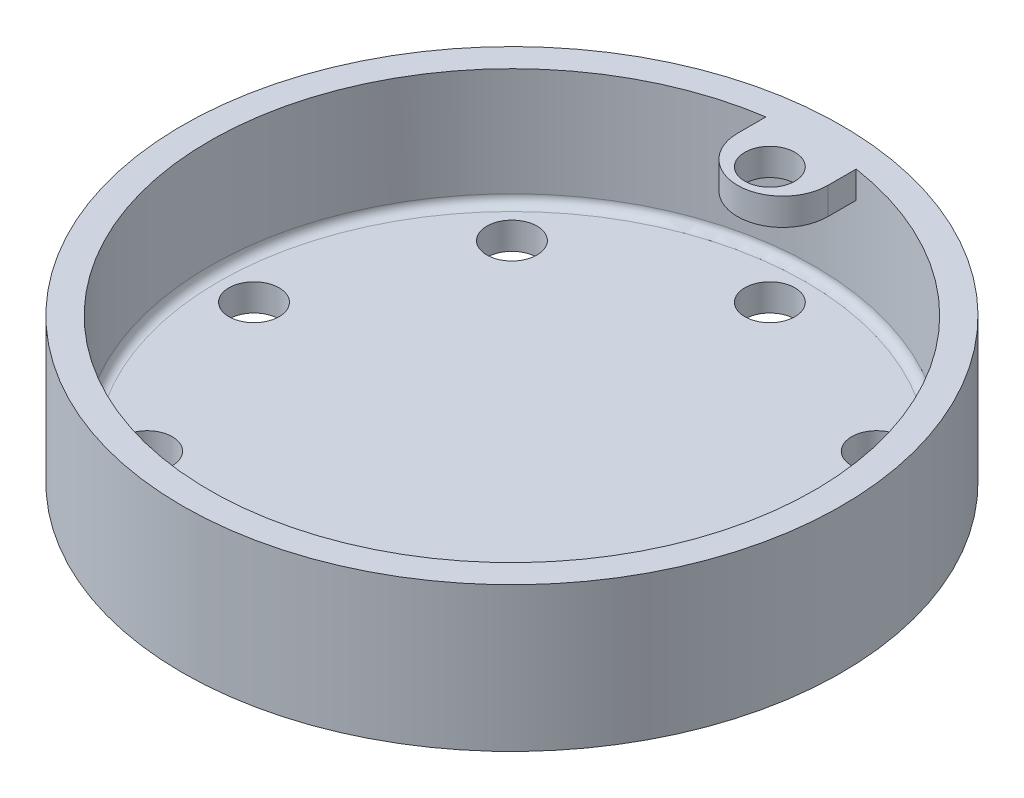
SolidWorks part; units mm, degrees
ref_plane "Front" through (0, 0, 0) normal (0, 0, 1) x (1, 0, 0)
ref_plane "Top" through (0, 0, 0) normal (0, 1, 0) x (1, 0, 0)
ref_plane "Right" through (0, 0, 0) normal (1, 0, 0) x (0, 0, -1)
sketch "Sketch1" plane through (0, 0, 0) normal (0, 1, 0) x (1, 0, 0)
  circle A0 centre (0, 0) radius 73.025
  dimension "D1" = 146.05
  dimension "D2" = 146.05
extrude "Base-Extrude" add sketch "Sketch1" along normal blind 32
shell "Shell1" thickness 6
sketch "Sketch4" plane through (0, 6, 0) normal (0, 1, 0) x (-1, 0, 0)
  line L0 (40.1361, -13.9766) -> (22.0065, -36.3588)
  circle A0 centre (0, 0) radius 42.5
  dimension "D1" = 85
extrude "Cut-Extrude2" cut sketch "Sketch4" against normal through all
sketch "Sketch2" plane through (0, 32, 0) normal (0, 1, 0) x (-1, 0, 0)
  line L0 (0, -73.025) -> (0, 73.025) construction
  line L1 (-10, -66.2748) -> (-10, -60)
  line L2 (10, -60) -> (10, -66.2748)
  line L3 (50, 0) -> (-50, 0) construction
  circle A0 centre (0, 0) radius 73.025 construction
  arc A1 (-10, -66.2748) -> (10, -66.2748) centre (0, 0) ccw
  circle A2 centre (0, 0) radius 67.025 construction
  arc A3 (-10, -60) -> (10, -60) centre (0, -60) cw
  dimension "D2" = 10
  dimension "D1" = 60
extrude "Boss-Extrude1" add sketch "Sketch2" against normal blind 6
sketch "Sketch3" plane through (0, 32, 0) normal (0, 1, 0) x (-1, 0, 0)
  circle A0 centre (0, -57.15) radius 5.5563
  arc A1 (10, -60) -> (-10, -60) centre (0, -60) ccw construction
  dimension "D1" = 11.1125
extrude "Cut-Extrude1" cut sketch "Sketch3" against normal up to next
fillet "Fillet1" radius 50
pattern_circular "CirPattern1" count 4 every 90
sketch "Sketch5" plane through (0, 6, 0) normal (0, 1, 0) x (-1, 0, 0)
  circle A0 centre (0, -57.15) radius 5.5563 construction
  circle A1 centre (0, -57.15) radius 5.5562
extrude "Cut-Extrude3" cut sketch "Sketch5" against normal through all
pattern_circular "CirPattern2" count 8 every 45 about axis through (0, 0, 0) along (0, 1, 0) of "Cut-Extrude3"
fillet "Fillet2" radius 2 1 edges at (0, 6, 67.025)
